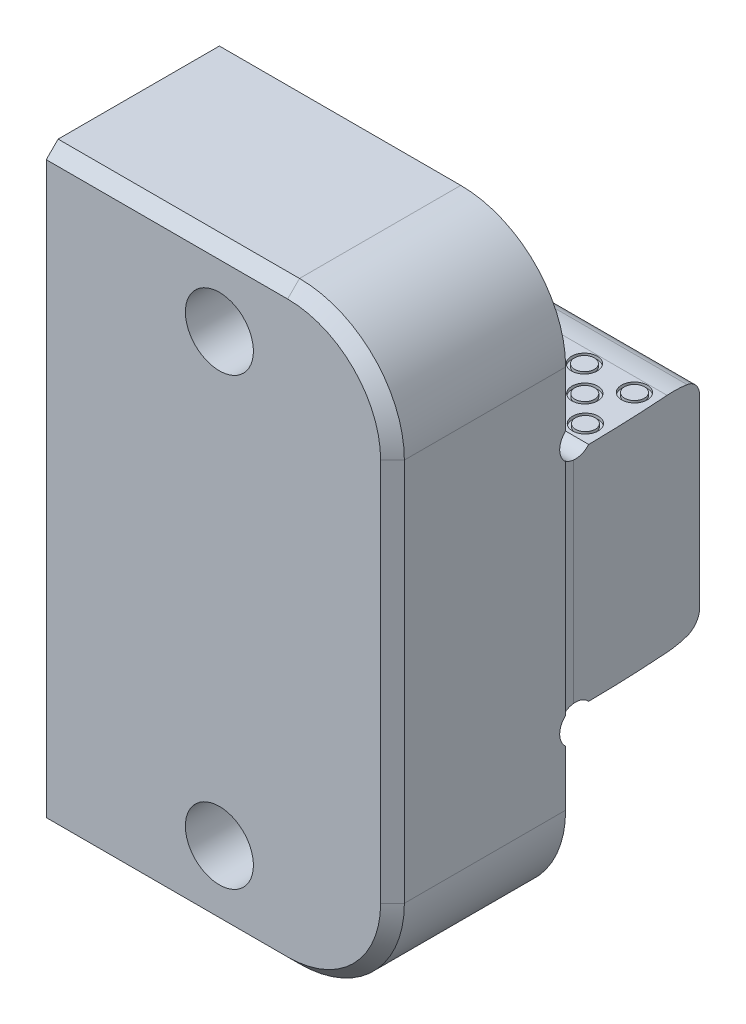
SolidWorks part; units mm, degrees
ref_plane "Front Plane" through (0, 0, 0) normal (0, 0, 1) x (1, 0, 0)
ref_plane "Top Plane" through (0, 0, 0) normal (0, 1, 0) x (1, 0, 0)
ref_plane "Right Plane" through (0, 0, 0) normal (1, 0, 0) x (0, 0, -1)
sketch "Sketch3" plane through (0, 0, 0) normal (1, 0, 0) x (0, 0, -1)
  line L0 (0, 24.4475) -> (0, -24.4475) construction
  line L1 (-22.225, -38.1) -> (0, -38.1)
  line L2 (-22.225, -38.1) -> (-22.225, 38.1)
  line L3 (-22.225, 38.1) -> (0, 38.1)
  line L4 (18.288, -14.285) -> (18.288, 14.285)
  line L6 (0, -38.1) -> (0, -14.285)
  line L7 (0, -14.285) -> (18.288, -14.285)
  line L8 (0, 38.1) -> (0, 14.285)
  line L9 (0, 14.285) -> (18.288, 14.285)
  line L10 (0, 0) -> (50000, 0) construction
  dimension "D1" = 40.513
  dimension "D2" = 22.225
  dimension "D3" = 76.2
  dimension "D4" = 28.5699
extrude "Extrude1" add sketch "Sketch3" along normal mid plane 44.45
sketch "Sketch7" plane through (22.225, 0, 0) normal (1, 0, 0) x (0, 0, -1)
  line L1 (0, -14.5526) -> (21.9683, -14.5526)
  line L2 (0, -14.5526) -> (0, 17.1683)
  line L3 (0, 17.1683) -> (21.9683, 17.1683)
  line L4 (21.9683, -14.5526) -> (21.9683, 17.1683)
  line L5 (0, -38.1) -> (0, -14.285) construction
extrude "Cut-Extrude3" cut sketch "Sketch7" against normal blind 0.254
sketch "Sketch8" plane through (22.225, 0, 0) normal (1, 0, 0) x (0, 0, -1)
  line L0 (0, 0) -> (50000, 0) construction
  line L1 (0, -38.1) -> (0, 38.1) construction
  line L2 (0, 14.285) -> (18.288, 14.285) construction
  circle A0 centre (1.524, 15.809) radius 2.286
  circle A1 centre (1.524, -15.809) radius 2.286
  dimension "D1" = 2.286
  dimension "D2" = 0.762
  dimension "D3" = 0.762
extrude "Cut-Extrude4" cut sketch "Sketch8" against normal through all
sketch "Sketch9" plane through (22.225, 0, 0) normal (1, 0, 0) x (0, 0, -1)
  line L0 (3.2279, 14.285) -> (18.288, 14.285) construction
  line L1 (18.288, 14.285) -> (18.288, -14.285) construction
  line L2 (0, 0) -> (50000, 0) construction
  line L3 (18.288, 11.745) -> (20.066, 11.745)
  line L4 (13.716, 14.285) -> (13.716, 18.095)
  line L5 (13.716, 18.095) -> (20.066, 18.095)
  line L6 (20.066, 11.745) -> (20.066, 18.095)
  line L7 (20.066, -11.745) -> (20.066, -18.095)
  line L8 (13.716, -18.095) -> (20.066, -18.095)
  line L9 (13.716, -14.285) -> (13.716, -18.095)
  line L10 (18.288, -11.745) -> (20.066, -11.745)
  arc A0 (13.716, 14.285) -> (16.5038, 13.9752) centre (13.716, 1.585) cw
  arc A1 (16.5038, 13.9752) -> (18.288, 11.745) centre (16.002, 11.745) cw
  arc A2 (16.5038, -13.9752) -> (18.288, -11.745) centre (16.002, -11.745) ccw
  arc A3 (13.716, -14.285) -> (16.5038, -13.9752) centre (13.716, -1.585) ccw
  dimension "D1" = 2.286
  dimension "D2" = 12.7
  dimension "D3" = 4.572
  dimension "D4" = 6.35
  dimension "D5" = 6.35
extrude "Cut-Extrude5" cut sketch "Sketch9" against normal through all
sketch "Sketch13" plane through (0, 38.1, 0) normal (0, 1, 0) x (1, 0, 0)
  line L0 (21.971, 3.2279) -> (21.971, 13.716) construction
  line L2 (20.1474, 26.67) -> (32.8474, 26.67)
  line L4 (21.971, 1.27) -> (32.8474, 1.27)
  line L5 (32.8474, 26.67) -> (32.8474, 1.27)
  arc A0 (20.1474, 26.67) -> (21.971, 1.27) centre (-155.829, 1.27) cw
  dimension "D1" = 177.8
  dimension "D2" = 1.27
  dimension "D3" = 25.4
  dimension "D4" = 12.7
extrude "Cut-Extrude6" cut sketch "Sketch13" against normal through all
sketch "Sketch15" plane through (0, 14.285, 0) normal (0, 1, 0) x (1, 0, 0)
  line L0 (-22.225, 13.716) -> (-22.225, 3.2279) construction
  line L1 (22.225, -22.225) -> (-22.225, -22.225) construction
  circle A0 centre (-13.0048, 11.938) radius 1.651
  circle A1 centre (-13.0048, 11.938) radius 1.27
  circle A2 centre (-6.5786, 11.938) radius 1.651
  circle A3 centre (-6.5786, 11.938) radius 1.27
  circle A4 centre (-19.431, 11.938) radius 1.651
  circle A5 centre (-19.431, 11.938) radius 1.27
  circle A6 centre (-0.1524, 11.938) radius 1.651
  circle A7 centre (-0.1524, 11.938) radius 1.27
  circle A8 centre (6.2738, 11.938) radius 1.651
  circle A9 centre (6.2738, 11.938) radius 1.27
  circle A10 centre (12.7, 11.938) radius 1.651
  circle A11 centre (12.7, 11.938) radius 1.27
  circle A12 centre (19.1262, 11.938) radius 1.651
  circle A13 centre (19.1262, 11.938) radius 1.27
  circle A14 centre (-9.7536, 8.636) radius 1.27
  circle A15 centre (-9.7536, 8.636) radius 1.651
  circle A16 centre (-3.302, 8.636) radius 1.27
  circle A17 centre (-3.302, 8.636) radius 1.651
  circle A18 centre (-16.2052, 8.636) radius 1.27
  circle A19 centre (-16.2052, 8.636) radius 1.651
  circle A20 centre (3.1496, 8.636) radius 1.27
  circle A21 centre (3.1496, 8.636) radius 1.651
  circle A22 centre (9.6012, 8.636) radius 1.27
  circle A23 centre (9.6012, 8.636) radius 1.651
  circle A24 centre (16.0528, 8.636) radius 1.27
  circle A25 centre (16.0528, 8.636) radius 1.651
  circle A26 centre (-12.954, 5.334) radius 1.27
  circle A27 centre (-12.954, 5.334) radius 1.651
  circle A28 centre (-6.477, 5.334) radius 1.27
  circle A29 centre (-6.477, 5.334) radius 1.651
  circle A30 centre (-19.431, 5.334) radius 1.27
  circle A31 centre (-19.431, 5.334) radius 1.651
  circle A32 centre (0, 5.334) radius 1.27
  circle A33 centre (0, 5.334) radius 1.651
  circle A34 centre (6.477, 5.334) radius 1.27
  circle A35 centre (6.477, 5.334) radius 1.651
  circle A36 centre (12.954, 5.334) radius 1.27
  circle A37 centre (12.954, 5.334) radius 1.651
  circle A38 centre (19.431, 5.334) radius 1.27
  circle A39 centre (19.431, 5.334) radius 1.651
  dimension "D1" = 2.794
  dimension "D2" = 6.0198
  dimension "D12" = 6.4262
  dimension "D7" = 3.302
  dimension "D8" = 2.54
  dimension "D3" = 34.163
  dimension "D4" = 3.302
  dimension "D5" = 3.302
  dimension "D6" = 6.4262
  dimension "D9" = 6.4262
  dimension "D10" = 6.4262
  dimension "D11" = 6.4262
  dimension "D13" = 6.4262
  dimension "D14" = 6.4516
  dimension "D15" = 6.4516
  dimension "D16" = 6.4516
  dimension "D17" = 6.4516
  dimension "D18" = 6.4516
  dimension "D19" = 6.477
  dimension "D20" = 6.477
  dimension "D21" = 6.477
  dimension "D22" = 6.477
  dimension "D23" = 6.477
  dimension "D24" = 6.477
extrude "Cut-Extrude7" cut sketch "Sketch15" against normal blind 0.381
mirror "Mirror1" about plane through (0, 0, 0) normal (0, 1, 0) of "Cut-Extrude7"
hole_wizard "5/16\"-18 CBORE" positions "Sketch11" profile "Sketch10" counterbore size "5/16" standard "Ansi Inch"
sketch "Sketch11" plane through (0, 0, 0) normal (0, 0, -1) x (-1, 0, 0)
  line L0 (0, 0) -> (0, 50000) construction
  line L1 (0, 0) -> (50000, 0) construction
  point P0 (0, 28.575)
  point P10 (0, -28.575)
  dimension "D1" = 57.15
sketch "Sketch10" plane through (0, 28.575, 0) normal (1, 0, 0) x (0, 1, 0)
  line L0 (0, 0) -> (0, 22.225)
  line L1 (0, 22.225) -> (4.365, 22.225)
  line L3 (4.365, 22.225) -> (4.365, 8.7312)
  line L4 (4.365, 8.7312) -> (6.7475, 8.7312)
  line L5 (6.7475, 8.7312) -> (6.7475, 0)
  line L7 (6.7475, 0) -> (0, 0)
  line L11 (0, -6.35) -> (0, 107.95) construction
  dimension "Thru Hole Dia." = 8.73
  dimension "Thru Hole Depth" = 22.225
  dimension "C'Bore Dia." = 13.495
  dimension "C'Bore Depth" = 8.7312
fillet "Fillet1" radius 13.462 2 edges at (22.225, -38.1, 11.1125) (22.225, 38.1, 11.1125)
chamfer "Chamfer1" distance 1.524 angle 45 5 edges at (-6.731, 38.1, 22.225) (-6.731, -38.1, 22.225) (22.225, 0, 22.225) (18.2821, 34.1571, 22.225) (18.2821, -34.1571, 22.225)
